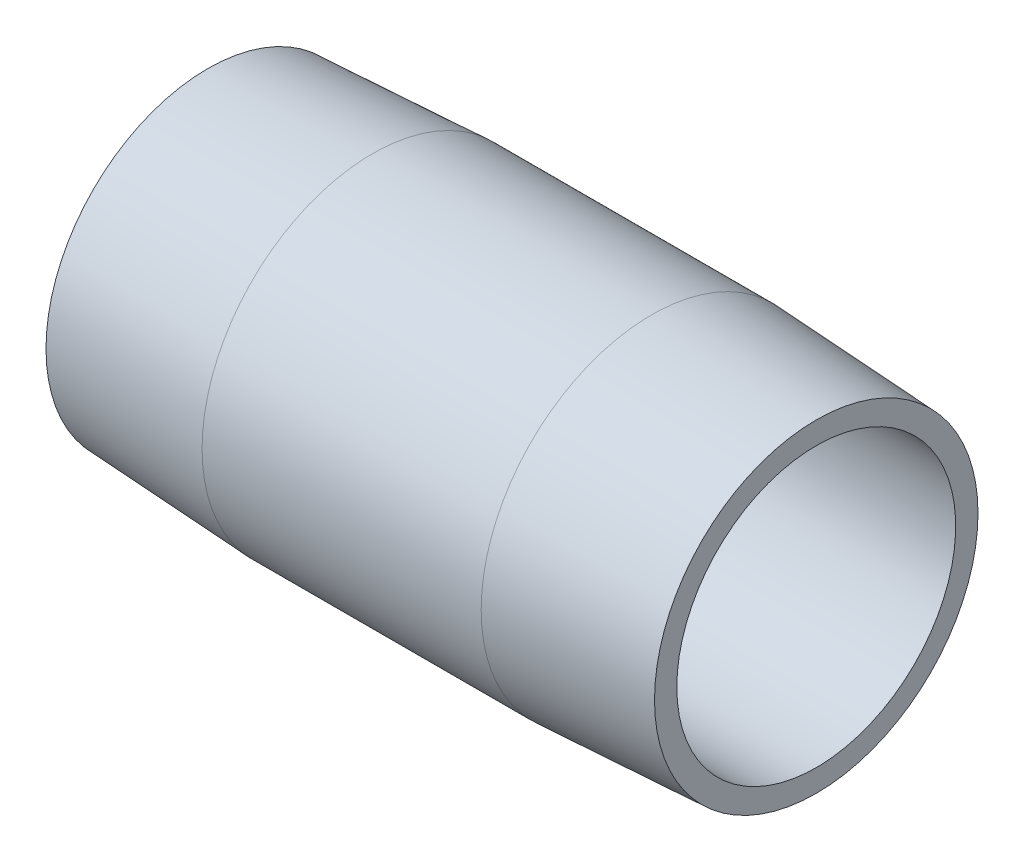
SolidWorks part; units mm, degrees
ref_plane "Front Plane" through (0, 0, 0) normal (0, 0, 1) x (1, 0, 0)
ref_plane "Top Plane" through (0, 0, 0) normal (0, 1, 0) x (1, 0, 0)
ref_plane "Right Plane" through (0, 0, 0) normal (1, 0, 0) x (0, 0, -1)
sketch "Sketch1" plane through (0, 0, 0) normal (0, 0, 1) x (1, 0, 0)
  line L6 (38.1, 8.7312) -> (0, 8.7313)
  line L7 (10.3124, 10.668) -> (0, 10.1276)
  line L8 (27.7876, 10.668) -> (10.3124, 10.668)
  line L9 (38.1, 10.1276) -> (27.7876, 10.668)
  line L10 (38.1, 8.7312) -> (38.1, 10.1276)
  line L11 (0, 10.1276) -> (0, 8.7313)
  line L12 (0, 0) -> (50000, 0) construction
  line L13 (0, -55) -> (0, 55) construction
  dimension "D1" = 38.1
  dimension "D2" = 3
  dimension "D3" = 3
  dimension "D4" = 21.336
  dimension "D5" = 17.4625
  dimension "D6" = 10.3124
  dimension "D7" = 10.3124
revolve "Revolve1" add sketch "Sketch1" angle 360 about L12
